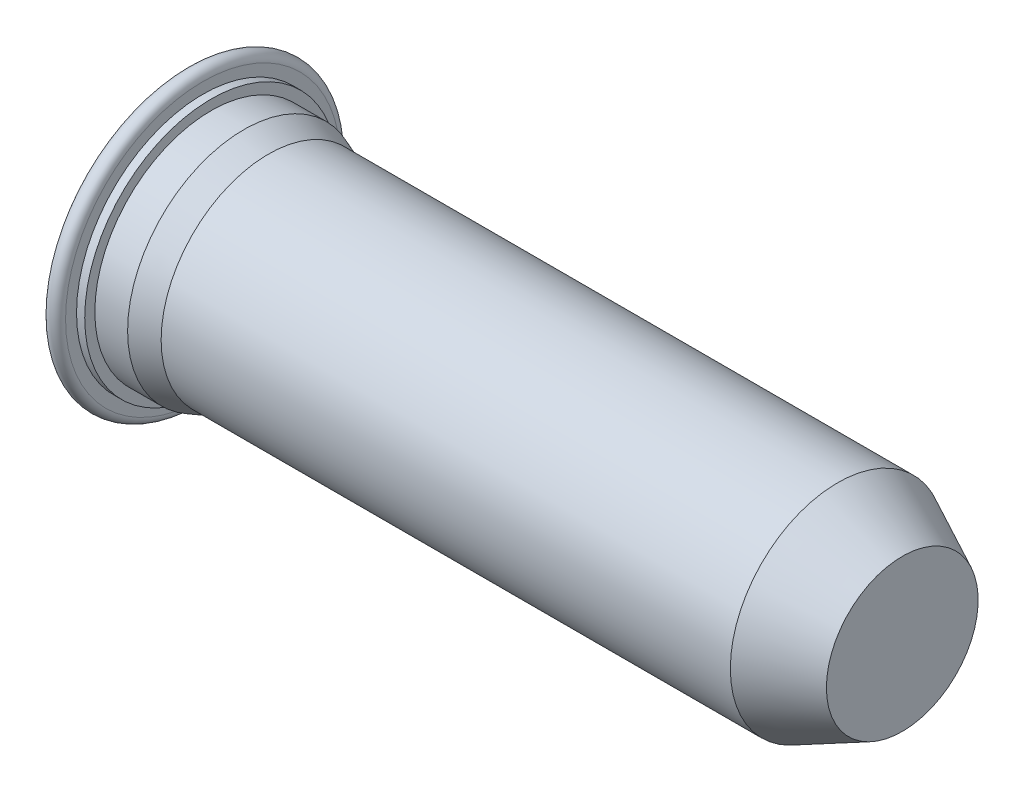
SolidWorks part; units mm, degrees
ref_plane "Plane1" through (0, 0, 0) normal (0, 0, 1) x (1, 0, 0)
ref_plane "Plane2" through (0, 0, 0) normal (0, 1, 0) x (1, 0, 0)
ref_plane "Plane3" through (0, 0, 0) normal (1, 0, 0) x (0, 0, -1)
sketch "BodySke" plane through (0, 0, 0) normal (0, 0, 1) x (1, 0, 0)
  line L0 (0, 0) -> (0, 3.8335)
  line L1 (0.458, 3.8385) -> (0.458, 3.5325)
  line L2 (20, 2.12) -> (18.1957, 3)
  line L3 (2.29, 3) -> (18.1957, 3)
  line L4 (20, 2.12) -> (20, 0)
  line L5 (20, 0) -> (0, 0)
  line L6 (0, 0) -> (50.554, 0) construction
  line L7 (0.458, 3.5325) -> (0.687, 3.5325)
  line L8 (1.6031, 3.25) -> (0.687, 3.25)
  line L9 (-9.525, 4.065) -> (9.525, 4.065) construction
  line L10 (0.687, 3.5325) -> (0.687, 3.25)
  line L11 (2.29, 3) -> (1.6031, 3.25)
  line L13 (9.525, -4.065) -> (-9.525, -4.065) construction
  line L14 (0.0051, 3.8385) -> (0.0051, 3.8335)
  line L15 (0, 3.8335) -> (0.0051, 3.8335)
  arc A0 (0.0051, 3.8385) -> (0.458, 3.8385) centre (0.2315, 3.8385) cw
  dimension "D2" = 0.0051
  dimension "D1" = 0.0051
  dimension "Diameter" = 6
  dimension "D3" = 20
  dimension "D4" = 64
  dimension "Length" = 20
  dimension "H_dia" = 8.13
  dimension "T_dim" = 0.458
  dimension "Neck_len" = 2.29
  dimension "Neck_dia" = 6.5
  dimension "D_dia" = 4.24
  dimension "Clinch_dia" = 7.065
  dimension "Clinch_ht" = 0.687
revolve "BaseBody" add sketch "BodySke" angle 360 about L6
equation "' \"Diameter@BodySke\" = 6"
equation "' \"Length@BodySke\" = 20"
equation "' \"Neck_dia@BodySke\" = 6.5"
equation "' \"H_dia@BodySke\" = 8.13"
equation "' \"Neck_len@BodySke\" = 2.29"
equation "' \"D_dia@BodySke\" = 4.24"
equation "\"T_dim@BodySke\" = \"Neck_len@BodySke\" * 0.2"
equation "\"Clinch_dia@BodySke\" = ( \"H_dia@BodySke\" + \"Diameter@BodySke\" ) / 2"
equation "\"Clinch_ht@BodySke\" = \"T_dim@BodySke\" * 1.5"
